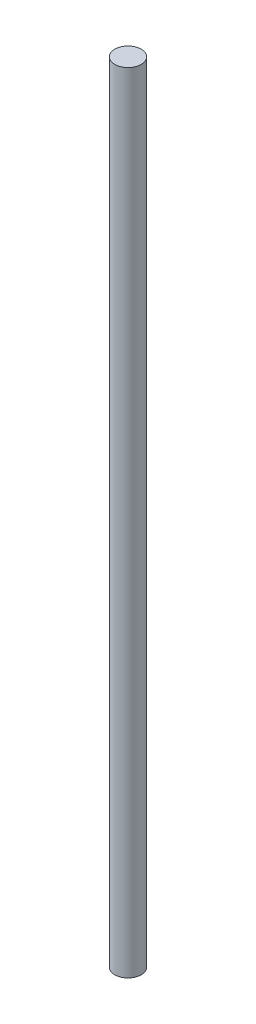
SolidWorks part; units mm, degrees
ref_plane "Front Plane" through (0, 0, 0) normal (0, 0, 1) x (1, 0, 0)
ref_plane "Top Plane" through (0, 0, 0) normal (0, 1, 0) x (1, 0, 0)
ref_plane "Right Plane" through (0, 0, 0) normal (1, 0, 0) x (0, 0, -1)
sketch "Sketch1" plane through (0, 0, 0) normal (0, 1, 0) x (1, 0, 0)
  circle A0 centre (0, 0) radius 23.8125
  dimension "D1" = 47.625
extrude "Extrude1" add sketch "Sketch1" along normal blind 1422.4
